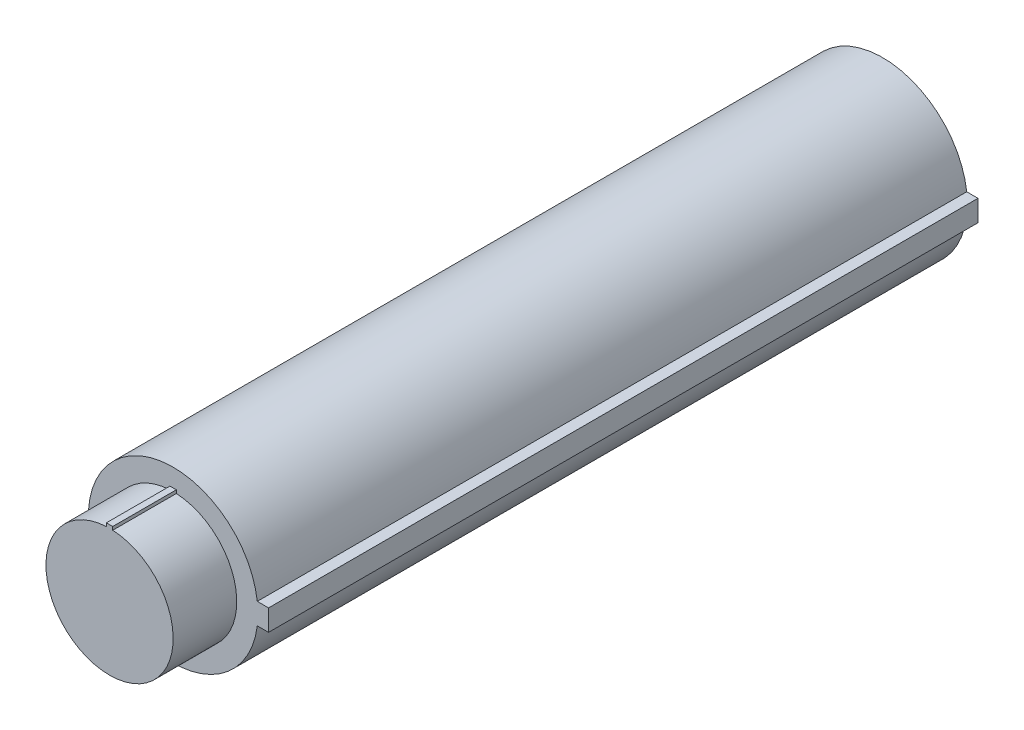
SolidWorks part; units mm, degrees
ref_plane "Alzado" through (0, 0, 0) normal (0, 0, 1) x (1, 0, 0)
ref_plane "Planta" through (0, 0, 0) normal (0, 1, 0) x (1, 0, 0)
ref_plane "Vista lateral" through (0, 0, 0) normal (1, 0, 0) x (0, 0, -1)
sketch "Croquis1" plane through (0, 0, 0) normal (1, 0, 0) x (0, 0, -1)
  line L0 (0, 0) -> (182.32, 0) construction
  line L1 (0, 0) -> (0, 15)
  line L2 (0, 15) -> (15, 15)
  line L3 (15, 15) -> (15, 20)
  line L4 (15, 20) -> (182.32, 20)
  line L5 (182.32, 20) -> (182.32, 0)
  line L6 (0, 0) -> (182.32, 0)
  dimension "D1" = 182.32
  dimension "D2" = 15
  dimension "D3" = 40
  dimension "D4" = 30
revolve "Revolución1" add sketch "Croquis1" angle 360 about L0
sketch "Croquis2" plane through (0, 0, 0) normal (0, 0, 1) x (1, 0, 0)
  line L1 (-0.75, 15.75) -> (0.75, 15.75)
  line L2 (-0.75, 15.75) -> (-0.75, 14.25)
  line L3 (-0.75, 14.25) -> (0.75, 14.25)
  line L4 (0.75, 15.75) -> (0.75, 14.25)
  line L5 (-0.75, 15.75) -> (0.75, 14.25) construction
  line L6 (-0.75, 14.25) -> (0.75, 15.75) construction
  circle A0 centre (0, 0) radius 15 construction
  circle A1 centre (0, 0) radius 15 construction
  point P0 (0, 15)
  dimension "D1" = 1.5
  dimension "D2" = 1.5
extrude "Saliente-Extruir1" add sketch "Croquis2" against normal up to surface (15 mm away)
sketch "Croquis3" plane through (0, 0, -182.32) normal (0, 0, -1) x (-1, 0, 0)
  line L1 (-22.5, -2.5) -> (-17.5, -2.5)
  line L2 (-22.5, -2.5) -> (-22.5, 2.5)
  line L3 (-22.5, 2.5) -> (-17.5, 2.5)
  line L4 (-17.5, -2.5) -> (-17.5, 2.5)
  line L5 (-22.5, -2.5) -> (-17.5, 2.5) construction
  line L6 (-22.5, 2.5) -> (-17.5, -2.5) construction
  circle A0 centre (0, 0) radius 20 construction
  point P0 (-20, 0)
  dimension "D1" = 5
  dimension "D2" = 5
extrude "Saliente-Extruir2" add sketch "Croquis3" against normal up to surface (167.32 mm away)
